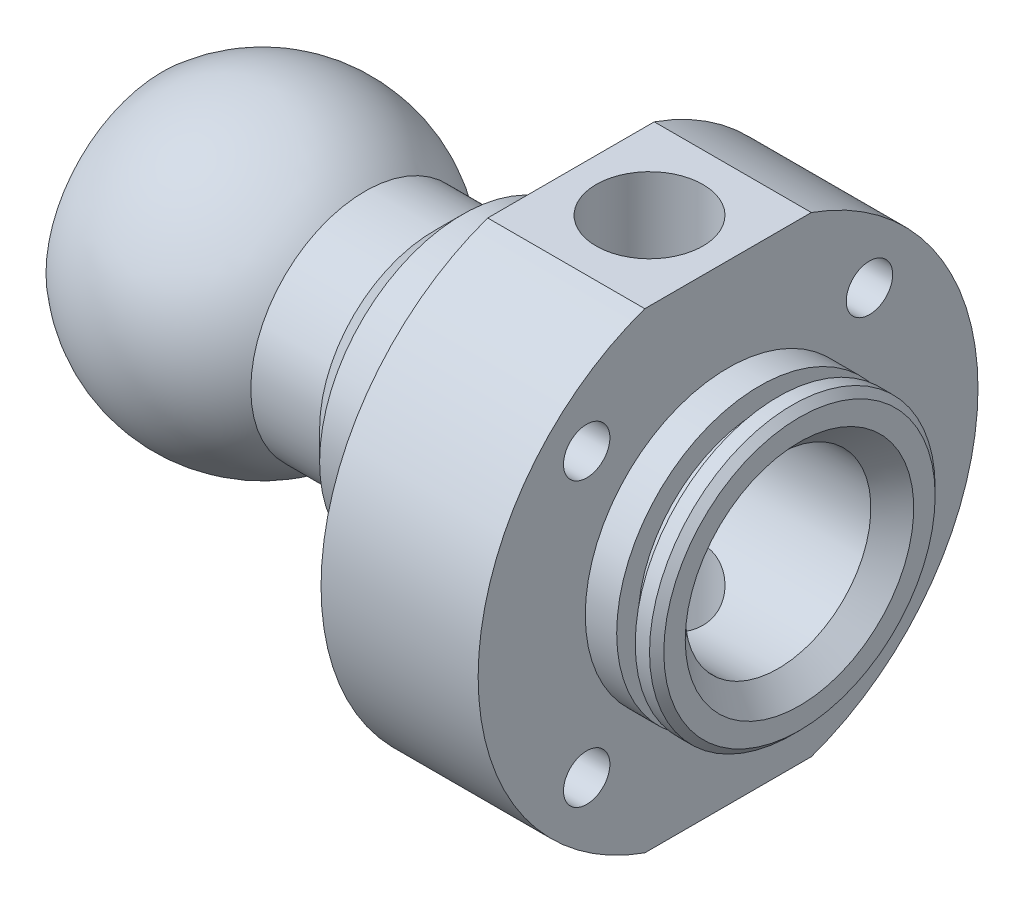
SolidWorks part; units mm, degrees
ref_plane "Plan1" through (0, 0, 0) normal (0, 0, 1) x (1, 0, 0)
ref_plane "Plan2" through (0, 0, 0) normal (0, 1, 0) x (1, 0, 0)
ref_plane "Plan3" through (0, 0, 0) normal (1, 0, 0) x (0, 0, -1)
sketch "Esquisse1" plane through (0, 0, 0) normal (0, 0, 1) x (1, 0, 0)
  line L0 (-69, 0) -> (68, 0) construction
  line L1 (39.1, 16) -> (39.1, 20)
  line L2 (39.1, 20) -> (36.1, 20)
  line L3 (36.1, 20) -> (36.1, 17)
  line L4 (36.1, 17) -> (33.5, 17)
  line L5 (33.5, 17) -> (33.5, 20)
  line L6 (33.5, 20) -> (29.1, 20)
  line L7 (29.1, 20) -> (29.1, 35)
  line L8 (29.1, 35) -> (7.1, 35)
  line L9 (7.1, 35) -> (7.1, 20)
  line L10 (7.1, 20) -> (-8.1, 20)
  line L11 (-8.1, 20) -> (-12.1, 16)
  line L12 (-12.1, 16) -> (-21.7386, 16)
  line L13 (-50.1, 16.3172) -> (-50.1, 10)
  line L14 (-50.1, 10) -> (-47.1, 10)
  line L15 (-47.1, 10) -> (-47.1, 13.25)
  line L16 (-47.1, 13.25) -> (-43.1, 13.25)
  line L17 (-43.1, 13.25) -> (-43.1, 10)
  line L18 (-43.1, 10) -> (-29, 10)
  line L19 (-29, 10) -> (-28.9, 10.1)
  line L20 (-28.9, 10.1) -> (8.2, 10.1)
  line L21 (8.2, 10.1) -> (11.1, 13)
  line L22 (11.1, 13) -> (36.1, 13)
  line L23 (36.1, 13) -> (39.1, 16)
  arc A0 (-21.7386, 16) -> (-50.1, 16.3172) centre (-36.1, 0) ccw
  dimension "D1" = 21.5
  dimension "D2" = 14
  dimension "D3" = 16
  dimension "D4" = 38
  dimension "D5" = 20
  dimension "D6" = 45
  dimension "D7" = 22
  dimension "D8" = 10
  dimension "D9" = 2.6
  dimension "D10" = 28
  dimension "D11" = 3
  dimension "D12" = 35
  dimension "D13" = 20
  dimension "D14" = 13
  dimension "D15" = 10.1
  dimension "D16" = 10
  dimension "D17" = 68
  dimension "D18" = 45
  dimension "D19" = 3
  dimension "D20" = 45
  dimension "D21" = 45
  dimension "D22" = 13.25
  dimension "D23" = 3
  dimension "D24" = 4
revolve "Base-Révolution" add sketch "Esquisse1" angle 360 about L0
sketch "Esquisse2" plane through (0, 0, 0) normal (0, 0, 1) x (1, 0, 0)
  line L0 (-66, 0) -> (64, 0) construction
  line L1 (-69, 0) -> (68, 0) construction
  line L2 (45, 33) -> (-60, 33)
  line L3 (45, -33) -> (-60, -33)
  line L4 (45, 33) -> (45, -33)
  line L5 (-60, 33) -> (-60, -33)
  point P9 (45, 0)
  point P10 (-60, 0)
  dimension "D1" = 66
extrude "Enlèv. mat.-Extru.1" cut sketch "Esquisse2" against normal mid plane 100 flip side to cut
sketch "Esquisse3" plane through (0, 33, 0) normal (0, 1, 0) x (-1, 0, 0)
  line L0 (69, 0) -> (-68, 0) construction
  line L1 (-29.1, 11.6619) -> (-29.1, -11.6619) construction
  circle A0 centre (-18.1, 0) radius 7.475
  dimension "D1" = 14.95
  dimension "D2" = 11
extrude "Enlèv. mat.-Extru.2" cut sketch "Esquisse3" against normal through all
sketch "Esquisse4" plane through (29.1, 0, 0) normal (1, 0, 0) x (0, 0, -1)
  line L0 (0, 0) -> (39, 0) construction
  line L1 (0, 0) -> (31.1448, -31.1448) construction
  circle A0 centre (19.799, -19.799) radius 3.25
  dimension "D2" = 6.5
  dimension "D1" = 45
  dimension "D3" = 28
extrude "Enlèv. mat.-Extru.3" cut sketch "Esquisse4" against normal through all
pattern_circular "Répétition circulaire1" count 4 every 90 about axis through (-69, 0, 0) along (1, 0, 0)
sketch "Esquisse5" plane through (0, 0, 0) normal (0, 0, 1) x (1, 0, 0)
  line L0 (-69, 0) -> (68, 0) construction
  line L2 (-50.1, 16.3172) -> (-50.1, -16.3172) construction
  point P0 (-36.1, 0)
  dimension "D1" = 14
chamfer "Chanfrein1" distance 1 angle 45
